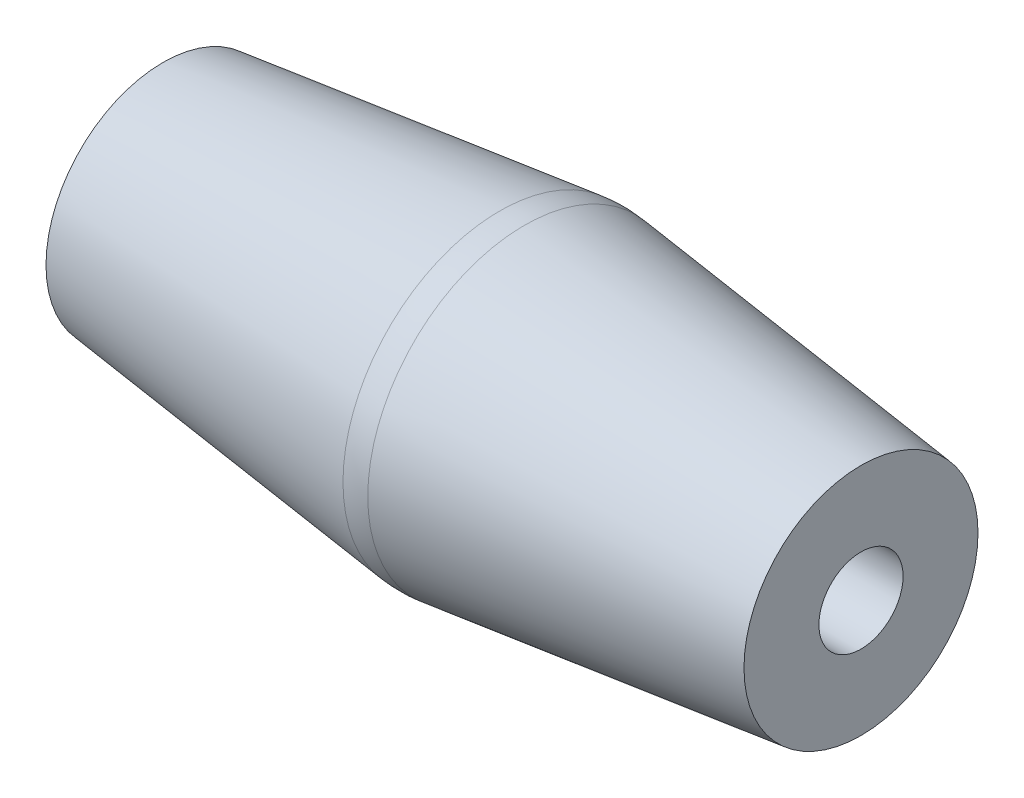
SolidWorks part; units mm, degrees
other "<MirrorRoller>-<<Roller>-<Imported1>>"
ref_plane "Front Plane" through (0, 0, 0) normal (0, 0, 1) x (1, 0, 0)
ref_plane "Top Plane" through (0, 0, 0) normal (0, 1, 0) x (1, 0, 0)
ref_plane "Right Plane" through (0, 0, 0) normal (1, 0, 0) x (0, 0, -1)
mirrored part "MirrorRoller_Mirrored"
